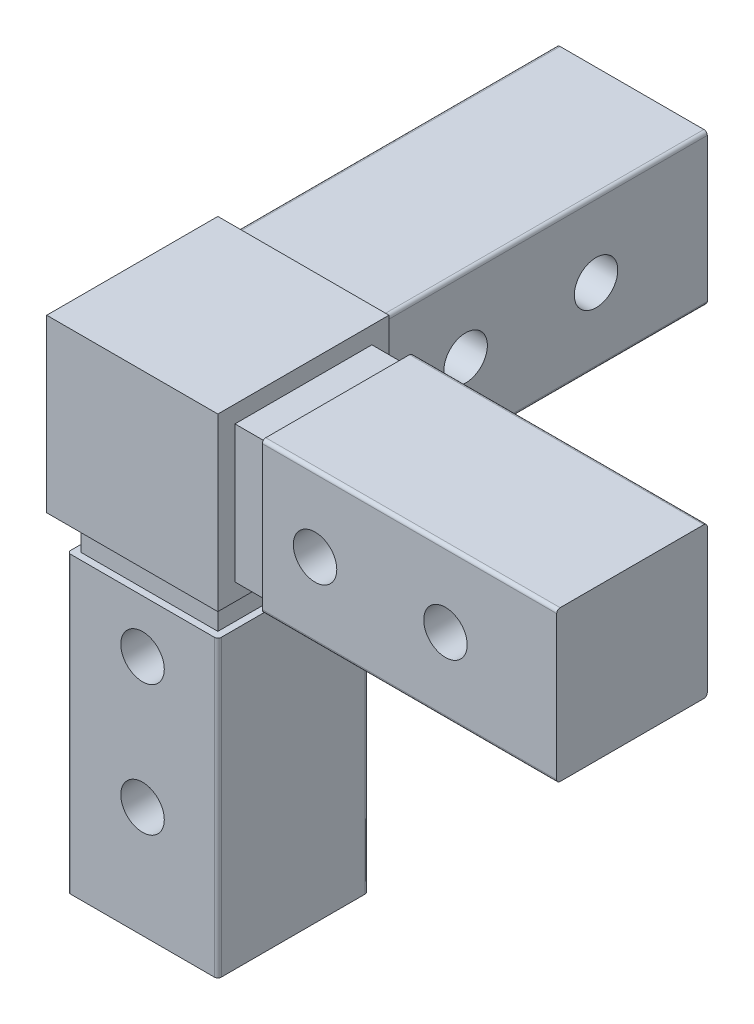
SolidWorks part; units mm, degrees
ref_plane "Front Plane" through (0, 0, 0) normal (0, 0, 1) x (1, 0, 0)
ref_plane "Top Plane" through (0, 0, 0) normal (0, 1, 0) x (1, 0, 0)
ref_plane "Right Plane" through (0, 0, 0) normal (1, 0, 0) x (0, 0, -1)
ref_plane "Plane1" through (0, 0, 10) normal (0, 0, 1) x (1, 0, 0)
sketch "Sketch1" plane through (0, 0, 10) normal (0, 0, 1) x (1, 0, 0)
  line L0 (-10, 10) -> (-10, -12.5)
  line L1 (-10, -12.5) -> (12.5, -12.5)
  line L2 (12.5, -12.5) -> (12.5, 10)
  line L3 (12.5, 10) -> (-10, 10)
extrude "Boss-Extrude1" add sketch "Sketch1" against normal blind 20
sketch "Sketch2" plane through (0, -12.5, 0) normal (0, -1, 0) x (1, 0, 0)
  line L0 (-10, -10) -> (-10, 10)
  line L1 (-10, 10) -> (10, 10)
  line L2 (10, 10) -> (10, -10)
  line L3 (10, -10) -> (-10, -10)
extrude "Boss-Extrude2" add sketch "Sketch2" along normal blind 5
sketch "Sketch3" plane through (12.5, 0, 0) normal (1, 0, 0) x (0, 0, -1)
  line L0 (-10, 10) -> (10, 10)
  line L1 (10, 10) -> (10, -10)
  line L2 (10, -10) -> (-10, -10)
  line L3 (-10, -10) -> (-10, 10)
extrude "Boss-Extrude3" add sketch "Sketch3" along normal blind 5
sketch "Sketch4" plane through (17.5, 0, 0) normal (1, 0, 0) x (0, 0, -1)
  line L0 (11, -10) -> (-10, -10)
  line L1 (-10, -10) -> (-10, 11)
  line L2 (-10, 11) -> (11, 11)
  line L3 (11, 11) -> (11, -10)
extrude "Boss-Extrude4" add sketch "Sketch4" along normal blind 43
ref_plane "Plane2" through (0, -17.5, 0) normal (0, 1, 0) x (1, 0, 0)
sketch "Sketch5" plane through (0, -17.5, 0) normal (0, 1, 0) x (1, 0, 0)
  line L0 (-11, 11) -> (-11, -11)
  line L1 (-11, -11) -> (11, -11)
  line L2 (11, -11) -> (11, 11)
  line L3 (11, 11) -> (-11, 11)
extrude "Boss-Extrude5" add sketch "Sketch5" against normal blind 43
sketch "Sketch6" plane through (0, 10, 0) normal (0, 1, 0) x (-1, 0, 0)
  line L0 (-12.5, 10) -> (10, 10)
  line L1 (10, 10) -> (10, -10)
  line L2 (10, -10) -> (-12.5, -10)
  line L3 (-12.5, -10) -> (-12.5, 10)
extrude "Boss-Extrude6" add sketch "Sketch6" along normal blind 2.5
sketch "Sketch7" plane through (0, 0, 10) normal (0, 0, 1) x (1, 0, 0)
  line L0 (-10, 12.5) -> (12.5, 12.5)
  line L1 (12.5, 12.5) -> (12.5, -12.5)
  line L2 (12.5, -12.5) -> (-10, -12.5)
  line L3 (-10, -12.5) -> (-10, 12.5)
extrude "Boss-Extrude7" add sketch "Sketch7" along normal blind 2.5
sketch "Sketch8" plane through (-10, 0, 0) normal (-1, 0, 0) x (0, 0, 1)
  line L0 (-10, 12.5) -> (12.5, 12.5)
  line L1 (12.5, 12.5) -> (12.5, -12.5)
  line L2 (12.5, -12.5) -> (-10, -12.5)
  line L3 (-10, -12.5) -> (-10, 12.5)
extrude "Boss-Extrude8" add sketch "Sketch8" along normal blind 2.5
sketch "Sketch9" plane through (0, 0, -10) normal (0, 0, -1) x (-1, 0, 0)
  line L0 (12.5, -12.5) -> (-12.5, -12.5)
  line L1 (-12.5, -12.5) -> (-12.5, 12.5)
  line L2 (-12.5, 12.5) -> (12.5, 12.5)
  line L3 (12.5, 12.5) -> (12.5, -12.5)
extrude "Boss-Extrude9" add sketch "Sketch9" along normal blind 2.5
sketch "Sketch10" plane through (0, -10, 0) normal (0, -1, 0) x (1, 0, 0)
  line L0 (60.5, 10) -> (60.5, -11)
  line L1 (60.5, -11) -> (17.5, -11)
  line L2 (17.5, -11) -> (17.5, 10)
  line L3 (17.5, 10) -> (60.5, 10)
extrude "Boss-Extrude10" add sketch "Sketch10" along normal blind 1
sketch "Sketch11" plane through (0, 0, 10) normal (0, 0, 1) x (1, 0, 0)
  line L0 (60.5, 11) -> (60.5, -11)
  line L1 (60.5, -11) -> (17.5, -11)
  line L2 (17.5, -11) -> (17.5, 11)
  line L3 (17.5, 11) -> (60.5, 11)
extrude "Boss-Extrude11" add sketch "Sketch11" along normal blind 1
sketch "Sketch12" plane through (0, 0, -12.5) normal (0, 0, -1) x (-1, 0, 0)
  line L0 (11, -11) -> (-11, -11)
  line L1 (-11, -11) -> (-11, 11)
  line L2 (-11, 11) -> (11, 11)
  line L3 (11, 11) -> (11, -11)
extrude "Boss-Extrude12" add sketch "Sketch12" along normal blind 48
fillet "Fillet1" radius 0.5 12 edges at (-11, -39, 11) (39, -11, 11) (39, 11, -11) (11, -11, -36.5) (11, -39, 11) (11, 11, -36.5) (39, 11, 11) (-11, 11, -36.5) (39, -11, -11) (-11, -39, -11) (-11, -11, -36.5) (11, -39, -11)
sketch "Sketch13" plane through (0, 0, 11) normal (0, 0, 1) x (1, 0, 0)
  line L0 (17.5, 0) -> (60.5, 0) construction
  line L1 (17.5, 10.5) -> (17.5, -10.5) construction
  line L2 (60.5, -10.5) -> (60.5, 10.5) construction
  line L3 (12.5, -10) -> (12.5, 10) construction
  circle A0 centre (44.25, 0) radius 3.175
  circle A1 centre (25.2, 0) radius 3.175
  dimension "D1" = 6.35
  dimension "D2" = 6.35
  dimension "D3" = 12.7
  dimension "D4" = 31.75
extrude "Cut-Extrude1" cut sketch "Sketch13" against normal up to surface (22 mm away)
sketch "Sketch15" plane through (0, 0, 11) normal (0, 0, 1) x (1, 0, 0)
  line L0 (0, -60.5) -> (0, -17.5) construction
  line L1 (-10.5, -60.5) -> (10.5, -60.5) construction
  line L2 (11.55, -17.5) -> (-11.55, -17.5) construction
  line L3 (-10, -12.5) -> (10, -12.5) construction
  circle A0 centre (0, -44.25) radius 3.175
  circle A1 centre (0, -25.2) radius 3.175
  dimension "D1" = 6.35
  dimension "D2" = 6.35
  dimension "D3" = 12.7
  dimension "D4" = 31.75
extrude "Cut-Extrude2" cut sketch "Sketch15" against normal up to surface (22 mm away)
ref_plane "Plane3" through (-10.5, -60.5, -11) normal (0, 1, 0) x (1, 0, 0)
sketch "Sketch16" plane through (-11, 0, 0) normal (-1, 0, 0) x (0, 0, 1)
  line L0 (-60.5, 0) -> (-12.5, 0) construction
  line L1 (-60.5, -10.5) -> (-60.5, 10.5) construction
  line L2 (-12.5, -12.5) -> (-12.5, 12.5) construction
  circle A0 centre (-25.2, 0) radius 3.175
  circle A1 centre (-44.25, 0) radius 3.175
  dimension "D3" = 6.35
  dimension "D4" = 6.35
  dimension "D1" = 12.7
  dimension "D2" = 31.75
extrude "Cut-Extrude3" cut sketch "Sketch16" against normal up to surface (22 mm away)
